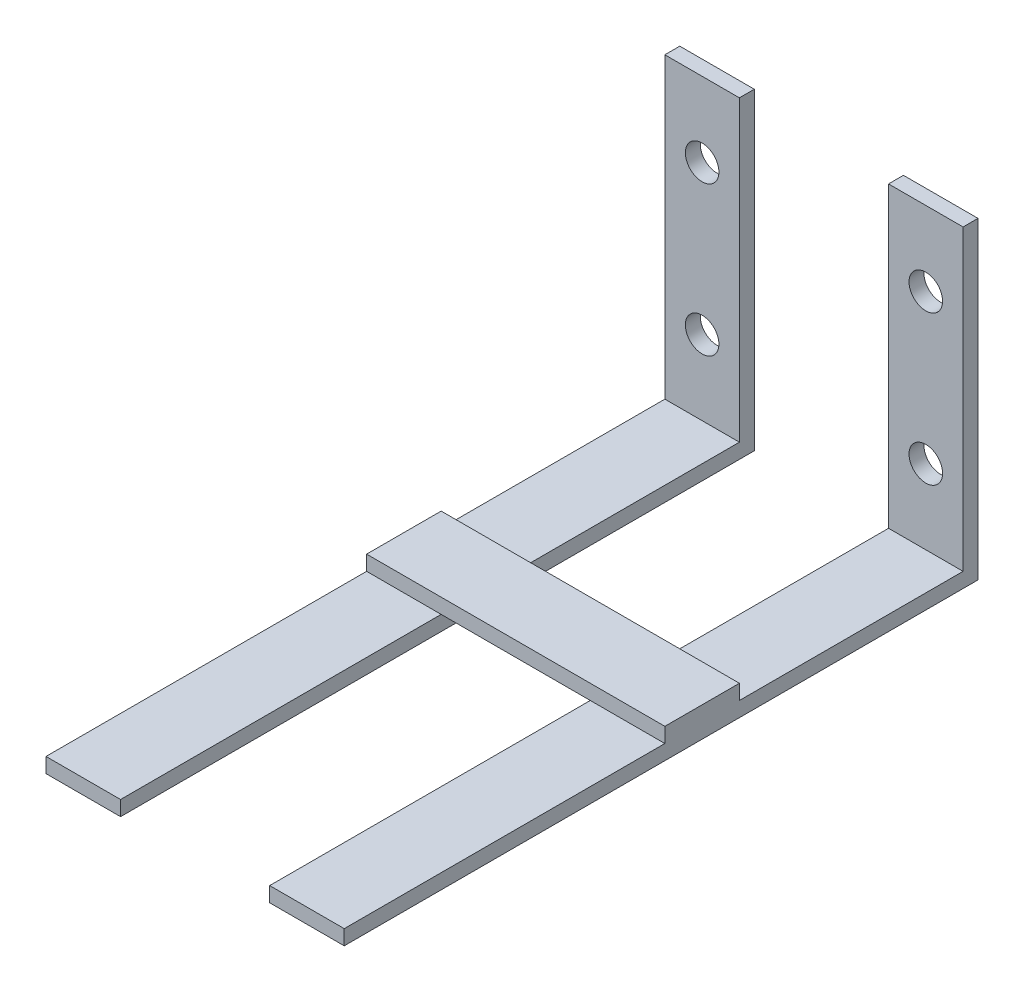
SolidWorks part; units mm, degrees
ref_plane "Piano frontale" through (0, 0, 0) normal (0, 0, 1) x (1, 0, 0)
ref_plane "Piano superiore" through (0, 0, 0) normal (0, 1, 0) x (1, 0, 0)
ref_plane "Piano destro" through (0, 0, 0) normal (1, 0, 0) x (0, 0, -1)
sketch "Schizzo1" plane through (0, 0, 0) normal (0, 1, 0) x (1, 0, 0)
  line L0 (0, 8.5909) -> (0, -30.3182) construction
  line L1 (-10, 0) -> (-20, 0)
  line L2 (-10, 0) -> (-10, -85)
  line L3 (-10, -85) -> (-20, -85)
  line L4 (-20, 0) -> (-20, -85)
  line L5 (10, -85) -> (20, -85)
  line L6 (20, 0) -> (20, -85)
  line L7 (10, 0) -> (20, 0)
  line L8 (10, 0) -> (10, -85)
extrude "Estrusione-Estrusione1" add sketch "Schizzo1" along normal blind 2
sketch "Schizzo2" plane through (0, 2, 0) normal (0, 1, 0) x (1, 0, 0)
  line L0 (-10, -85) -> (-10, 0) construction
  line L1 (-20, 0) -> (-10, 0)
  line L2 (-20, 0) -> (-20, -2)
  line L3 (-20, -2) -> (-10, -2)
  line L4 (-10, 0) -> (-10, -2)
  line L5 (0, 8.5174) -> (0, -8.2302) construction
  line L6 (20, -2) -> (10, -2)
  line L7 (10, 0) -> (10, -2)
  line L8 (20, 0) -> (10, 0)
  line L9 (20, 0) -> (20, -2)
  dimension "D1" = 2
extrude "Estrusione-Estrusione2" add sketch "Schizzo2" along normal blind 40
sketch "Schizzo3" plane through (0, 2, 0) normal (0, 1, 0) x (1, 0, 0)
  line L0 (-20, -2) -> (-20, -85) construction
  line L1 (-20, -32) -> (20, -32)
  line L2 (-20, -32) -> (-20, -42)
  line L3 (-20, -42) -> (20, -42)
  line L4 (20, -32) -> (20, -42)
  line L5 (20, -85) -> (20, -2) construction
  line L6 (-20, -2) -> (-10, -2) construction
  dimension "D1" = 30
  dimension "D2" = 10
extrude "Estrusione-Estrusione3" add sketch "Schizzo3" along normal blind 2
hole_wizard "Foro per Vite M4-1" positions "Schizzo4" profile "Schizzo5" hole size "M4" standard "ISO"
sketch "Schizzo4" plane through (0, 0, 2) normal (0, 0, 1) x (1, 0, 0)
  line L0 (-20, 42) -> (-10, 42) construction
  point P0 (-15, 32)
  point P2 (-15, 12)
  point P4 (15, 32)
  point P6 (15, 12)
  dimension "D1" = 15
  dimension "D2" = 30
  dimension "D3" = 20
  dimension "D4" = 10
sketch "Schizzo5" plane through (-15, 32, 2) normal (1, 0, 0) x (0, -1, 0)
  line L0 (0, 0) -> (0, 2)
  line L1 (0, 2) -> (2.25, 2)
  line L2 (2.25, 2) -> (2.25, 0)
  line L5 (2.25, 0) -> (0, 0)
  line L11 (0, -6.35) -> (0, 107.95) construction
  dimension "Thru Hole Dia." = 4.5
  dimension "Thru Hole Depth" = 2
equation "\"D2@Schizzo1\"=55+30"
equation "\"D4@Schizzo1\"=\"D2@Schizzo1\""
